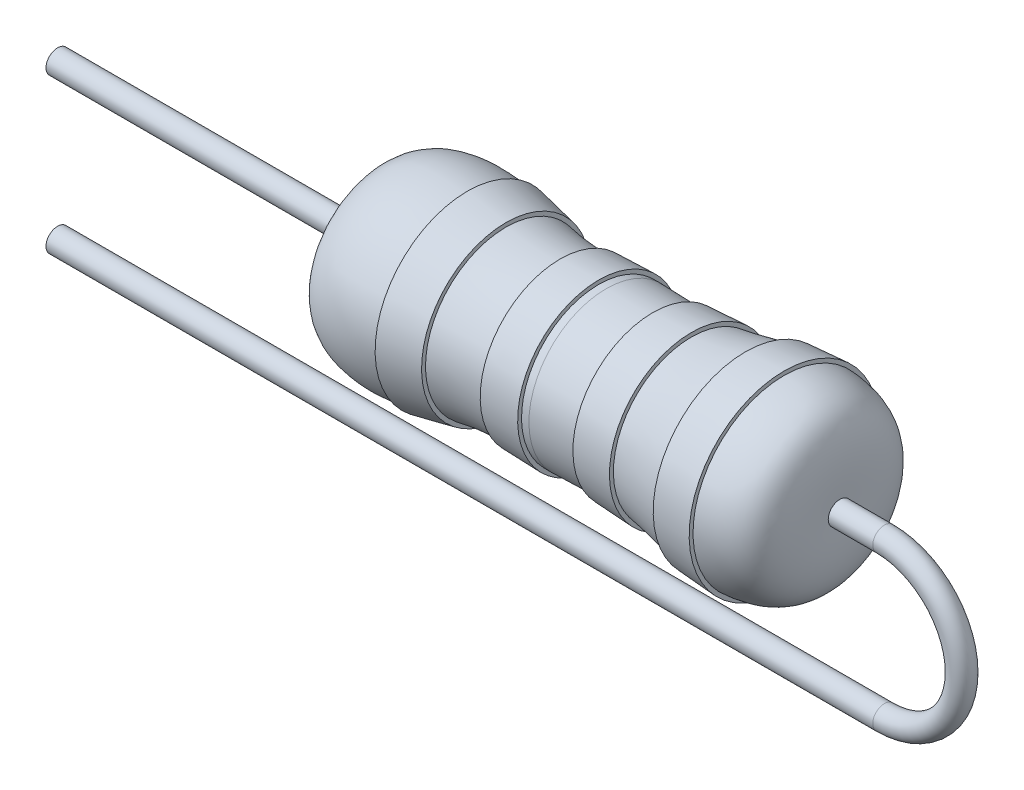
SolidWorks part; units mm, degrees
ref_plane "Plan de face" through (0, 0, 0) normal (0, 0, 1) x (1, 0, 0)
ref_plane "Plan de dessus" through (0, 0, 0) normal (0, 1, 0) x (1, 0, 0)
ref_plane "Plan de droite" through (0, 0, 0) normal (1, 0, 0) x (0, 0, -1)
sketch "Esquisse1" plane through (0, 0, 0) normal (0, 0, 1) x (1, 0, 0)
  line L0 (-3, 0) -> (3, 0) construction
  line L1 (0, 0) -> (0, 2.6167) construction
  line L2 (3.1, 0) -> (-3.1, 0)
  line L3 (-3.8693, 0) -> (4.2011, 0) construction
  line L4 (-3.1, 0.15) -> (-3.0236, 0.15)
  line L5 (3.1, 0.15) -> (3.1, 0)
  line L6 (-3.1, 0.15) -> (-3.1, 0)
  line L7 (3.0236, 0.15) -> (3.1, 0.15)
  line L8 (2.3026, 1.1791) -> (2.3026, 1.2291)
  line L9 (1.8026, 1.1944) -> (1.8026, 1.1437)
  line L10 (1.1026, 1.0606) -> (1.1026, 1.0094)
  line L11 (0.6026, 1.0333) -> (0.6026, 0.9837)
  line L12 (-0.0974, 1.0485) -> (-0.0974, 0.9983)
  line L13 (-1.7974, 1.1935) -> (-1.2974, 1.0923)
  line L14 (-0.5974, 1.0334) -> (-0.0974, 1.0485)
  line L15 (0.6026, 1.0333) -> (1.1026, 1.0606)
  line L16 (1.8026, 1.1944) -> (2.3026, 1.2291)
  line L18 (-0.5974, 1.0334) -> (-0.5974, 0.9837)
  line L21 (-1.2974, 1.0923) -> (-1.2974, 1.0412)
  line L23 (-1.7974, 1.1935) -> (-1.7974, 1.1428)
  point P7 (0, 1)
  point P12 (-2.3026, 1.1791)
  point P16 (-1.0233, 1)
  point P24 (2.8439, 1)
  point P28 (-2.8439, 1)
  dimension "D1" = 3.1
  dimension "D2" = 3
  dimension "D3" = 3.1
  dimension "D4" = 0.15
  dimension "D6" = 0.5
  dimension "D7" = 0.5
  dimension "D8" = 0.7
  dimension "D9" = 0.5
  dimension "D10" = 0.7
  dimension "D11" = 0.5
  dimension "D13" = 0.7
revolve "Révolution2" add sketch "Esquisse1" angle 360 about L2
sketch "Esquisse2" plane through (3.1, 0, 0) normal (1, 0, 0) x (0, 0, -1)
  circle A1 centre (0, 0) radius 0.15
  circle A2 centre (0, 0) radius 0.15
  dimension "D1" = 0
sketch "Esquisse3" plane through (0, 0, 0) normal (0, 0, 1) x (1, 0, 0)
  line L0 (3.6, -2) -> (-7.1, -2)
  line L1 (3.1, 0) -> (3.6, 0)
  line L2 (3.1, -0.15) -> (3.1, 0.15) construction
  line L4 (-3.1, 0.15) -> (-3.1, -0.15) construction
  arc A0 (4.6, -1) -> (3.6, 0) centre (3.6, -1) ccw
  arc A1 (4.6, -1) -> (3.6, -2) centre (3.6, -1) cw
  point P8 (4.6, 0)
  dimension "D3" = 1
  dimension "D1" = 1
  dimension "D2" = 1.5
  dimension "D4" = 4
  dimension "D5" = 2
sweep "Balayage1" add profiles "Esquisse2" path "Esquisse3"
mirror "Symétrie1" about plane through (0, 0, 0) normal (1, 0, 0)
sketch "Esquisse4" plane through (-3.1, 0, 0) normal (-1, 0, 0) x (0, 0, 1)
  circle A1 centre (0, 0) radius 0.15
  circle A2 centre (0, 0) radius 0.15
  dimension "D1" = 0
extrude "Extrusion1" add sketch "Esquisse4" along normal blind 4
